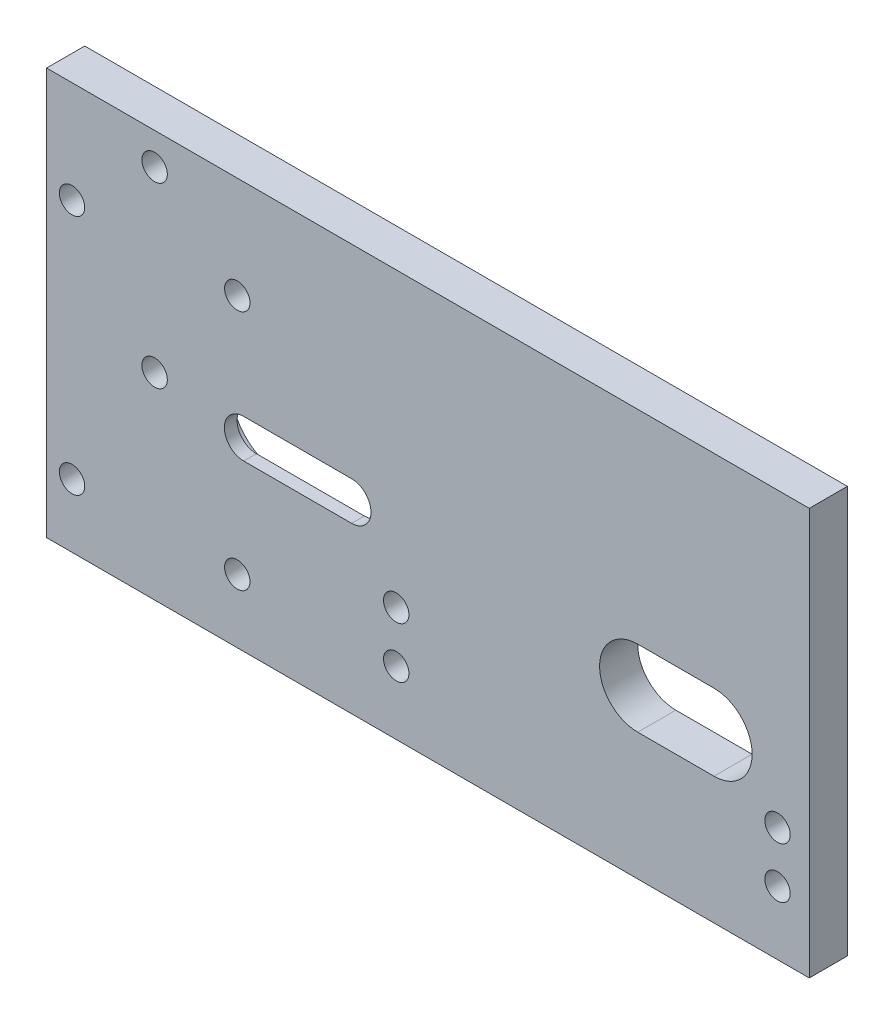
SolidWorks part; units mm, degrees
ref_plane "Front Plane" through (0, 0, 0) normal (0, 0, 1) x (1, 0, 0)
ref_plane "Top Plane" through (0, 0, 0) normal (0, 1, 0) x (1, 0, 0)
ref_plane "Right Plane" through (0, 0, 0) normal (1, 0, 0) x (0, 0, -1)
sketch "Sketch1" plane through (0, 0, 0) normal (0, 0, 1) x (1, 0, 0)
  line L0 (0, 0) -> (190.5, 0)
  line L1 (190.5, 0) -> (190.5, 101.6)
  line L2 (190.5, 101.6) -> (0, 101.6)
  line L3 (0, 101.6) -> (0, 0)
  line L4 (80.9752, 34.925) -> (80.9752, 9.525)
  line L5 (80.9752, 9.525) -> (188.9252, 9.525)
  line L6 (188.9252, 9.525) -> (188.9252, 34.925)
  line L7 (188.9252, 34.925) -> (80.9752, 34.925)
  line L8 (80.9752, 22.225) -> (87.3252, 22.225)
  line L9 (87.3252, 22.225) -> (87.3252, 28.575)
  line L10 (49.2252, 46.0248) -> (76.2, 46.0248) construction
  line L11 (87.3252, 22.225) -> (87.3252, 15.875)
  line L12 (188.9252, 22.225) -> (182.5752, 22.225)
  line L13 (182.5752, 22.225) -> (182.5752, 28.575)
  line L14 (182.5752, 22.225) -> (182.5752, 15.875)
  line L15 (49.2252, 50.8508) -> (76.2, 50.8508)
  line L16 (49.2252, 41.1988) -> (76.2, 41.1988)
  line L17 (49.2252, 46.0248) -> (76.2, 46.0248) construction
  line L18 (49.2252, 58.7248) -> (76.2, 58.7248)
  line L19 (49.2252, 33.3248) -> (76.2, 33.3248)
  line L20 (147.6502, 41.275) -> (166.7002, 41.275) construction
  line L21 (147.6502, 50.8) -> (166.7002, 50.8)
  line L22 (147.6502, 31.75) -> (166.7002, 31.75)
  circle A0 centre (6.35, 15.8623) radius 3.175
  circle A1 centre (47.625, 15.8623) radius 3.175
  circle A2 centre (6.35, 76.1873) radius 3.175
  circle A3 centre (47.625, 76.1873) radius 3.175
  circle A4 centre (87.3252, 28.575) radius 3.175
  circle A5 centre (87.3252, 15.875) radius 3.175
  circle A6 centre (182.5752, 28.575) radius 3.175
  circle A7 centre (182.5752, 15.875) radius 3.175
  arc A8 (49.2252, 50.8508) -> (49.2252, 41.1988) centre (49.2252, 46.0248) ccw
  arc A9 (76.2, 41.1988) -> (76.2, 50.8508) centre (76.2, 46.0248) ccw
  circle A10 centre (157.1752, 41.275) radius 9.525
  circle A11 centre (26.9748, 93.6752) radius 3.175
  circle A12 centre (26.9748, 49.2252) radius 3.175
  arc A13 (49.2252, 58.7248) -> (49.2252, 33.3248) centre (49.2252, 46.0248) ccw
  arc A14 (76.2, 33.3248) -> (76.2, 58.7248) centre (76.2, 46.0248) ccw
  arc A15 (147.6502, 50.8) -> (147.6502, 31.75) centre (147.6502, 41.275) ccw
  arc A16 (166.7002, 31.75) -> (166.7002, 50.8) centre (166.7002, 41.275) ccw
  point P31 (62.7126, 46.0248)
  point P44 (62.7126, 46.0248)
  point P51 (157.1752, 41.275)
  dimension "D5" = 6.35
  dimension "D11" = 6.35
  dimension "D15" = 46.0248
  dimension "D16" = 4.826
  dimension "D20" = 19.05
  dimension "D21" = 6.35
  dimension "D26" = 12.7
  dimension "D29" = 9.525
  dimension "D1" = 101.6
  dimension "D2" = 190.5
  dimension "D3" = 60.325
  dimension "D4" = 6.35
  dimension "D6" = 33.3248
  dimension "D7" = 41.275
  dimension "D8" = 1.5748
  dimension "D9" = 107.95
  dimension "D10" = 25.4
  dimension "D12" = 12.7
  dimension "D13" = 6.35
  dimension "D14" = 9.525
  dimension "D17" = 49.2252
  dimension "D18" = 26.9748
  dimension "D19" = 41.275
  dimension "D22" = 44.45
  dimension "D23" = 26.9748
  dimension "D24" = 7.9248
  dimension "D25" = 76.2
  dimension "D27" = 9.525
  dimension "D28" = 9.525
sketch "Sketch2" plane through (0, 0, 0) normal (0, 0, 1) x (1, 0, 0)
  line L0 (0, 0) -> (190.5, 0) construction
  line L1 (190.5, 0) -> (190.5, 101.6) construction
  line L2 (190.5, 101.6) -> (0, 101.6) construction
  line L3 (0, 101.6) -> (0, 0) construction
  line L4 (0, 0) -> (190.5, 0)
  line L5 (190.5, 0) -> (190.5, 101.6)
  line L6 (190.5, 101.6) -> (0, 101.6)
  line L7 (0, 101.6) -> (0, 0)
  line L8 (49.2252, 41.1988) -> (76.2, 41.1988) construction
  line L9 (49.2252, 50.8508) -> (76.2, 50.8508) construction
  line L10 (49.2252, 41.1988) -> (76.2, 41.1988)
  line L11 (49.2252, 50.8508) -> (76.2, 50.8508)
  line L12 (147.6502, 31.75) -> (166.7002, 31.75) construction
  line L13 (147.6502, 50.8) -> (166.7002, 50.8) construction
  line L14 (147.6502, 31.75) -> (166.7002, 31.75)
  line L15 (147.6502, 50.8) -> (166.7002, 50.8)
  circle A0 centre (47.625, 15.8623) radius 3.175 construction
  circle A1 centre (6.35, 15.8623) radius 3.175 construction
  circle A2 centre (6.35, 76.1873) radius 3.175 construction
  circle A3 centre (47.625, 76.1873) radius 3.175 construction
  circle A4 centre (47.625, 15.8623) radius 3.175
  circle A5 centre (6.35, 15.8623) radius 3.175
  circle A6 centre (6.35, 76.1873) radius 3.175
  circle A7 centre (47.625, 76.1873) radius 3.175
  circle A8 centre (87.3252, 15.875) radius 3.175 construction
  circle A9 centre (87.3252, 28.575) radius 3.175 construction
  circle A10 centre (182.5752, 15.875) radius 3.175 construction
  circle A11 centre (182.5752, 28.575) radius 3.175 construction
  circle A12 centre (87.3252, 15.875) radius 3.175
  circle A13 centre (87.3252, 28.575) radius 3.175
  circle A14 centre (182.5752, 15.875) radius 3.175
  circle A15 centre (182.5752, 28.575) radius 3.175
  arc A16 (49.2252, 50.8508) -> (49.2252, 41.1988) centre (49.2252, 46.0248) ccw construction
  arc A17 (76.2, 41.1988) -> (76.2, 50.8508) centre (76.2, 46.0248) ccw construction
  arc A18 (49.2252, 50.8508) -> (49.2252, 41.1988) centre (49.2252, 46.0248) ccw
  arc A19 (76.2, 41.1988) -> (76.2, 50.8508) centre (76.2, 46.0248) ccw
  arc A21 (166.7002, 31.75) -> (166.7002, 50.8) centre (166.7002, 41.275) ccw construction
  circle A22 centre (26.9748, 49.2252) radius 3.175 construction
  circle A23 centre (26.9748, 93.6752) radius 3.175 construction
  circle A24 centre (26.9748, 49.2252) radius 3.175
  circle A25 centre (26.9748, 93.6752) radius 3.175
  arc A26 (147.6502, 50.8) -> (147.6502, 31.75) centre (147.6502, 41.275) ccw construction
  arc A27 (166.7002, 31.75) -> (166.7002, 50.8) centre (166.7002, 41.275) ccw
  arc A28 (147.6502, 50.8) -> (147.6502, 31.75) centre (147.6502, 41.275) ccw
extrude "Boss-Extrude1" add sketch "Sketch2" along normal blind 9.525
sketch "Sketch3" plane through (0, 0, 0) normal (0, 0, 1) x (1, 0, 0)
  line L0 (49.2252, 33.3248) -> (76.2, 33.3248) construction
  line L1 (49.2252, 58.7248) -> (76.2, 58.7248) construction
  line L2 (49.2252, 33.3248) -> (76.2, 33.3248)
  line L3 (49.2252, 58.7248) -> (76.2, 58.7248)
  arc A0 (76.2, 33.3248) -> (76.2, 58.7248) centre (76.2, 46.0248) ccw construction
  arc A1 (49.2252, 58.7248) -> (49.2252, 33.3248) centre (49.2252, 46.0248) ccw construction
  arc A2 (76.2, 33.3248) -> (76.2, 58.7248) centre (76.2, 46.0248) ccw
  arc A3 (49.2252, 58.7248) -> (49.2252, 33.3248) centre (49.2252, 46.0248) ccw
extrude "Cut-Extrude1" cut sketch "Sketch3" along normal blind 6.35
